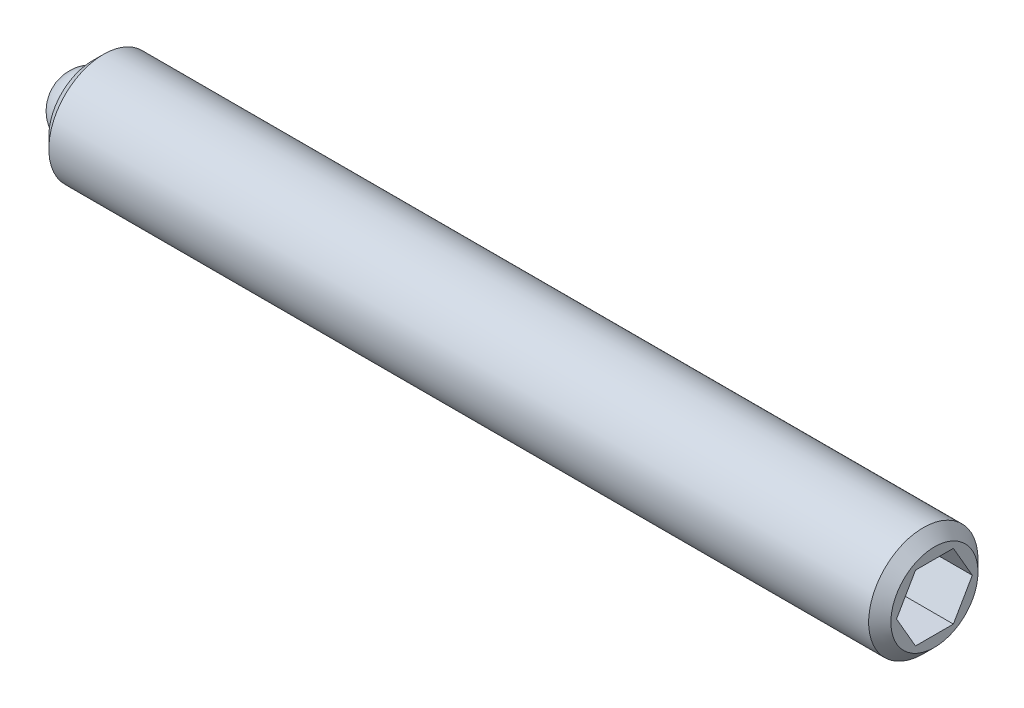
SolidWorks part; units mm, degrees
ref_plane "Front Plane" through (0, 0, 0) normal (0, 0, 1) x (1, 0, 0)
ref_plane "Top Plane" through (0, 0, 0) normal (0, 1, 0) x (1, 0, 0)
ref_plane "Right Plane" through (0, 0, 0) normal (1, 0, 0) x (0, 0, -1)
sketch "Sketch2" plane through (0, 0, 0) normal (1, 0, 0) x (0, 0, -1)
  circle A0 centre (0, 0) radius 1.25
  dimension "D1" = 2.5
extrude "Boss-Extrude1" add sketch "Sketch2" along normal blind 19.25
sketch "Sketch3" plane through (0, 0, 0) normal (-1, 0, 0) x (0, 0, 1)
  circle A0 centre (0, 0) radius 0.75
  dimension "D1" = 1.5
chamfer "Chamfer1" distance 0.254 angle 45 1 edges at (0, 0, -1.25)
chamfer "Chamfer2" distance 0.254 angle 45 1 edges at (19.25, 0, -1.25)
sketch "Sketch4" plane through (19.25, 0, 0) normal (1, 0, 0) x (0, 0, -1)
  line L1 (0.866, 0) -> (0.433, 0.75)
  line L2 (0.433, 0.75) -> (-0.433, 0.75)
  line L3 (-0.433, 0.75) -> (-0.866, 0)
  line L4 (-0.866, 0) -> (-0.433, -0.75)
  line L5 (-0.433, -0.75) -> (0.433, -0.75)
  line L6 (0.433, -0.75) -> (0.866, 0)
  circle A0 centre (0, 0) radius 0.75 construction
  dimension "D1" = 1.5
extrude "Cut-Extrude2" cut sketch "Sketch4" against normal blind 2
extrude "Cut-Extrude3" cut sketch "Sketch3" against normal blind 0.8
sketch "Sketch5" plane through (0, 0, 0) normal (-1, 0, 0) x (0, 0, 1)
  line L0 (0, 0) -> (0, -0.75)
  line L1 (0, 0) -> (0, 0.75)
  arc A0 (0, 0.75) -> (0, -0.75) centre (0, 0) ccw
  dimension "D1" = 0.75
revolve "Revolve1" add sketch "Sketch5" angle 360 about L1
